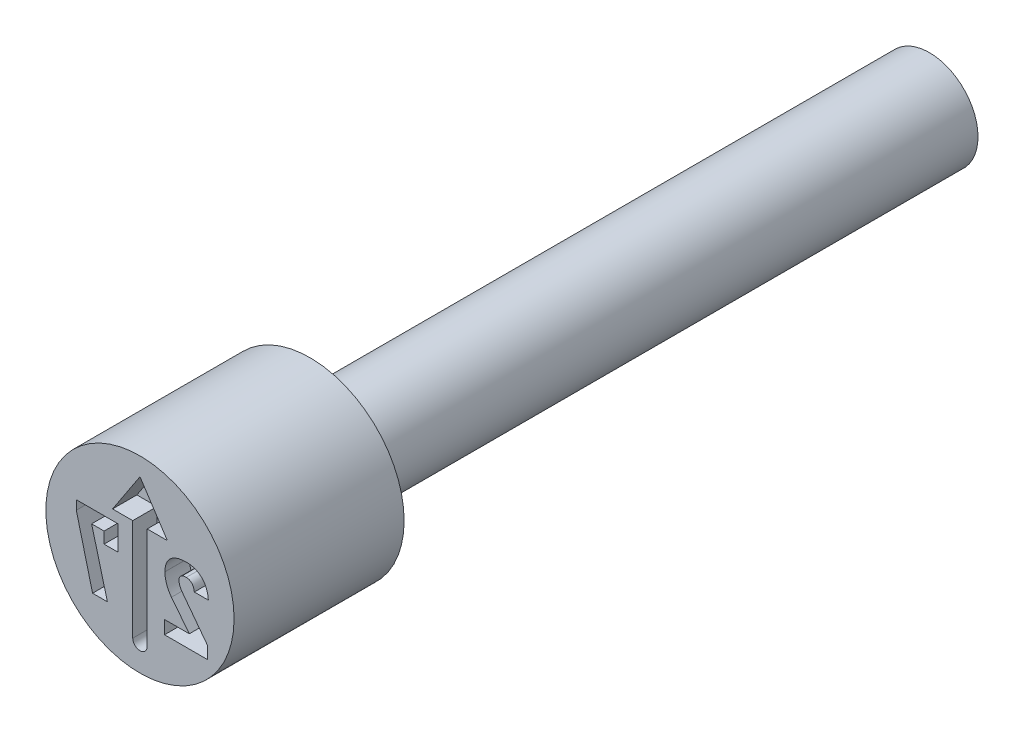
SolidWorks part; units mm, degrees
ref_plane "Front Plane" through (0, 0, 0) normal (0, 0, 1) x (1, 0, 0)
ref_plane "Top Plane" through (0, 0, 0) normal (0, 1, 0) x (1, 0, 0)
ref_plane "Right Plane" through (0, 0, 0) normal (1, 0, 0) x (0, 0, -1)
sketch "Sketch2" plane through (0, 0, 0) normal (1, 0, 0) x (0, 0, -1)
  line L0 (0.4039, 0) -> (50000.4039, 0) construction
  line L6 (0, 1.55) -> (0, 0)
  line L7 (2.8, 1.55) -> (0, 1.55)
  line L8 (2.8, 0.8) -> (2.8, 1.55)
  line L9 (13, 0.8) -> (2.8, 0.8)
  line L10 (13, 0) -> (13, 0.8)
  line L11 (0, 0) -> (13, 0)
  dimension "D1" = 3.1
  dimension "D2" = 1.6
  dimension "D3" = 13
  dimension "D4" = 2.8
revolve "Revolve1" add sketch "Sketch2" angle 360 about L0
sketch "Sketch3" plane through (0, 0, 0) normal (0, 0, 1) x (1, 0, 0)
  line L0 (0, 0) -> (0, 62500) construction
  line L1 (0.119, 0.5665) -> (0.119, -1.1101)
  line L2 (0.4512, 0.5665) -> (0.119, 0.5665)
  line L3 (0, 1.2513) -> (0.4512, 0.5665)
  line L15 (0, 1.2513) -> (-0.4512, 0.5665)
  line L16 (-0.4512, 0.5665) -> (-0.119, 0.5665)
  line L17 (-0.119, 0.5665) -> (-0.119, -1.1101)
  arc A2 (-0.119, -1.1101) -> (0.119, -1.1101) centre (0, -1.1101) ccw
extrude "Cut-Extrude4" cut sketch "Sketch3" against normal blind 0.4
sketch "Sketch4" plane through (0, 0, 0) normal (0, 0, 1) x (1, 0, 0)
  text T0 "2  7" font "Bahnschrift" height 1.2
  dimension "D1" = 0.8
  dimension "D2" = 1.2
extrude "Cut-Extrude5" cut sketch "Sketch4" against normal blind 0.4
